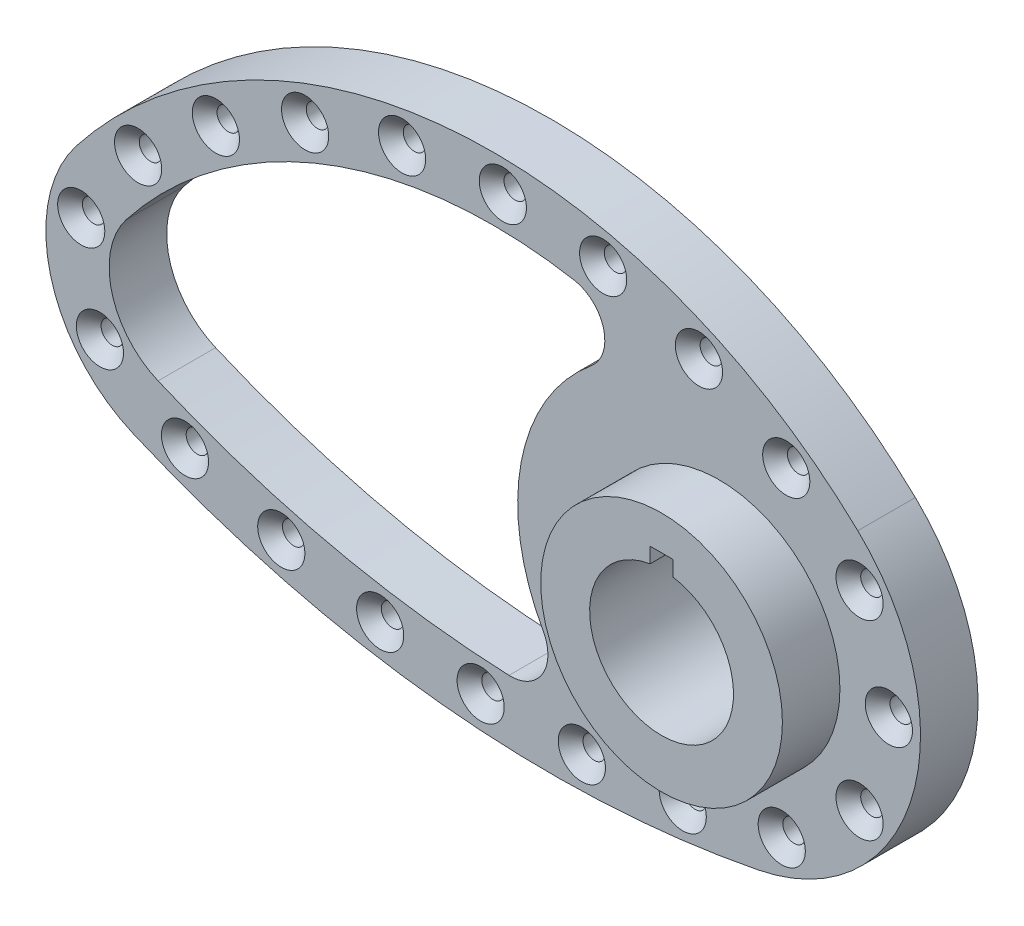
SolidWorks part; units mm, degrees
ref_plane "Front" through (0, 0, 0) normal (0, 0, 1) x (1, 0, 0)
ref_plane "Top" through (0, 0, 0) normal (0, 1, 0) x (1, 0, 0)
ref_plane "Right" through (0, 0, 0) normal (1, 0, 0) x (0, 0, -1)
sketch "Sketch1" plane through (0, 0, 0) normal (0, 0, 1) x (1, 0, 0)
  arc A0 (6.8022, -34.3326) -> (24.1076, 25.3737) centre (0, 0) ccw
  arc A1 (-111.6788, 15.419) -> (24.1076, 25.3737) centre (-39.2609, -41.3229) cw
  arc A2 (-111.6788, 15.419) -> (-101.82, -22.9906) centre (-92, 0) ccw
  arc A3 (-101.82, -22.9906) -> (6.8022, -34.3326) centre (-29.1522, 147.1399) ccw
  dimension "D1" = 35
  dimension "D2" = 92
  dimension "D3" = 25
  dimension "D4" = 185
  dimension "D5" = 92
extrude "Base-Extrude" add sketch "Sketch1" along normal mid plane 10
sketch "Sketch2" plane through (0, 0, 5) normal (0, 0, 1) x (1, 0, 0)
  arc A9 (-97.4992, -12.8747) -> (4.6643, -23.5424) centre (-29.1522, 147.1399) ccw
  arc A10 (-103.0201, 8.6346) -> (-97.4992, -12.8747) centre (-92, 0) ccw
  arc A11 (16.5309, 17.3991) -> (-103.0201, 8.6346) centre (-39.2609, -41.3229) ccw
  arc A12 (-97.4992, -12.8747) -> (-36.5219, -26.704) centre (-29.1522, 147.1399) ccw
  arc A13 (-103.0201, 8.6346) -> (-97.4992, -12.8747) centre (-92, 0) ccw
  arc A14 (-25.2361, 38.4537) -> (-103.0201, 8.6346) centre (-39.2609, -41.3229) ccw
  arc A15 (-22.2326, 27.0317) -> (-30.5694, -17.0444) centre (0, 0) ccw
  arc A16 (6.8022, -34.3326) -> (24.1076, 25.3737) centre (0, 0) ccw construction
  arc A17 (-25.2361, 38.4537) -> (-22.2326, 27.0317) centre (-26.3615, 32.0518) cw
  arc A18 (-36.5219, -26.704) -> (-30.5694, -17.0444) centre (-36.2466, -20.2098) ccw
  dimension "D2" = 6.5
  dimension "D1" = 11
extrude "Cut-Extrude1" cut sketch "Sketch2" against normal through all
sketch "Sketch3" plane through (0, 0, 5) normal (0, 0, 1) x (1, 0, 0)
  circle A0 centre (0, 0) radius 21
  dimension "D1" = 42
extrude "Boss-Extrude1" add sketch "Sketch3" along normal blind 10
sketch "Sketch4" plane through (0, 0, 15) normal (0, 0, 1) x (1, 0, 0)
  line L0 (0, 0) -> (0, -42.3208) construction
  line L2 (-2, 12.339) -> (-2, 15)
  line L3 (-2, 15) -> (2, 15)
  line L4 (2, 12.339) -> (2, 15)
  arc A0 (-2, 12.339) -> (2, 12.339) centre (0, 0) ccw
  dimension "D1" = 25
  dimension "D2" = 4
  dimension "D3" = 2.5
extrude "Cut-Extrude2" cut sketch "Sketch4" against normal through all
sketch "Sketch5" plane through (0, 0, 5) normal (0, 0, 1) x (1, 0, 0)
  arc A8 (-107.3494, 12.0268) -> (-99.6596, -17.9327) centre (-92, 0) ccw
  arc A9 (-99.6596, -17.9327) -> (5.7333, -28.9375) centre (-29.1522, 147.1399) ccw
  arc A10 (5.7333, -28.9375) -> (20.3192, 21.3864) centre (0, 0) ccw
  arc A11 (20.3192, 21.3864) -> (-107.3494, 12.0268) centre (-39.2609, -41.3229) ccw
  arc A12 (-107.3494, 12.0268) -> (-99.6596, -17.9327) centre (-92, 0) ccw
  arc A13 (-99.6596, -17.9327) -> (5.7333, -28.9375) centre (-29.1522, 147.1399) ccw
  arc A14 (5.7333, -28.9375) -> (20.3192, 21.3864) centre (0, 0) ccw
  arc A15 (20.3192, 21.3864) -> (-107.3494, 12.0268) centre (-39.2609, -41.3229) ccw
  dimension "D1" = 5.5
hole_wizard "CSK for M3.5 Flat Head Machine Screw1" positions "Sketch7" profile "Sketch6" countersink size "M3.5" standard "Ansi Metric"
sketch "Sketch7" plane through (0, 0, 5) normal (0, 0, 1) x (1, 0, 0)
  arc A0 (5.7333, -28.9375) -> (20.3192, 21.3864) centre (0, 0) ccw construction
  point P0 (29.5, 0)
sketch "Sketch6" plane through (29.5, 0, 5) normal (1, 0, 0) x (0, -1, 0)
  line L0 (0, 0) -> (0, 10)
  line L1 (0, 10) -> (1.95, 10)
  line L2 (1.95, 10) -> (1.95, 2.15)
  line L3 (1.95, 2.15) -> (4.1, 0)
  line L5 (4.1, 0) -> (0, 0)
  line L6 (-1.95, 2.15) -> (-4.1, 0) construction
  line L11 (0, -6.35) -> (0, 107.95) construction
  dimension "Thru Hole Dia." = 3.9
  dimension "Thru Hole Depth" = 10
  dimension "Near C'Sink Dia." = 8.2
  dimension "Near C'Sink Angle" = 90
pattern_curve "CrvPattern1" of "CSK for M3.5 Flat Head Machine Screw1" parameters "D1"=20, "D3"=5.08, "D2"=1, "D4"=12.7
